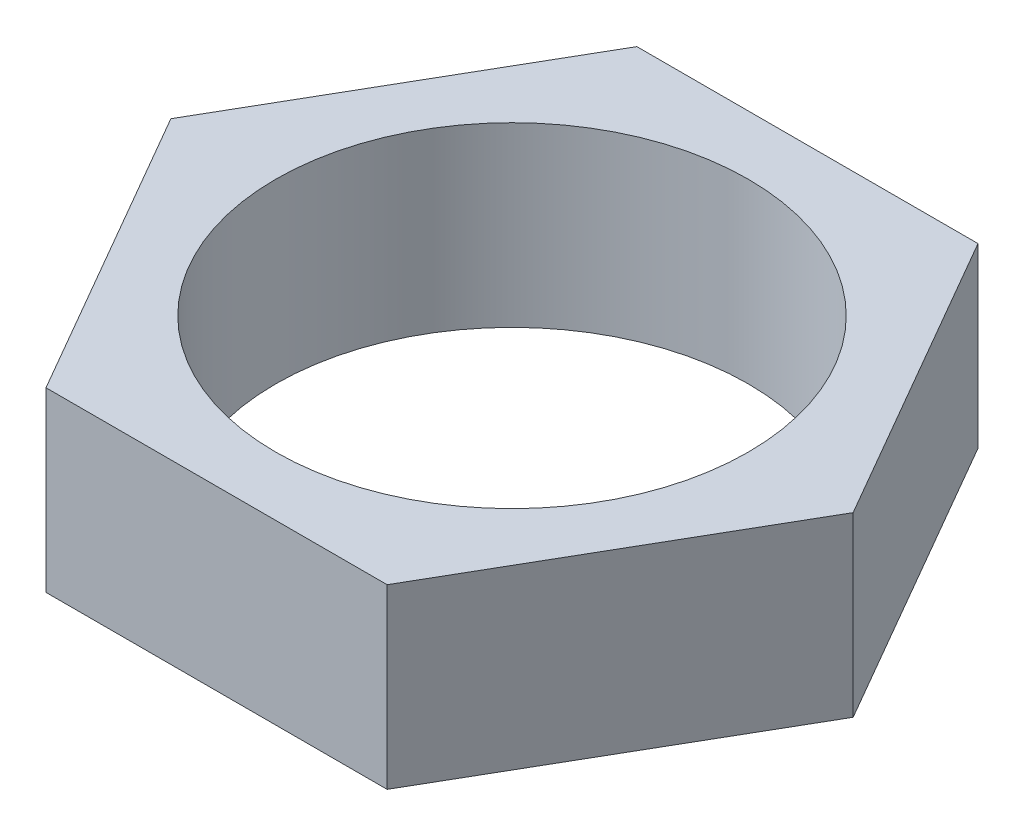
SolidWorks part; units mm, degrees
ref_plane "Plan de face" through (0, 0, 0) normal (0, 0, 1) x (1, 0, 0)
ref_plane "Plan de dessus" through (0, 0, 0) normal (0, 1, 0) x (1, 0, 0)
ref_plane "Plan de droite" through (0, 0, 0) normal (1, 0, 0) x (0, 0, -1)
sketch "Esquisse1" plane through (0, 0, 0) normal (0, 1, 0) x (1, 0, 0)
  line L1 (2.8868, -5) -> (5.7735, 0)
  line L2 (5.7735, 0) -> (2.8868, 5)
  line L3 (2.8868, 5) -> (-2.8868, 5)
  line L4 (-2.8868, 5) -> (-5.7735, 0)
  line L5 (-5.7735, 0) -> (-2.8868, -5)
  line L6 (-2.8868, -5) -> (2.8868, -5)
  circle A0 centre (0, 0) radius 5 construction
  circle A1 centre (0, 0) radius 4
  dimension "D2" = 8
  dimension "D1" = 10
extrude "Extrusion1" add sketch "Esquisse1" along normal blind 3
